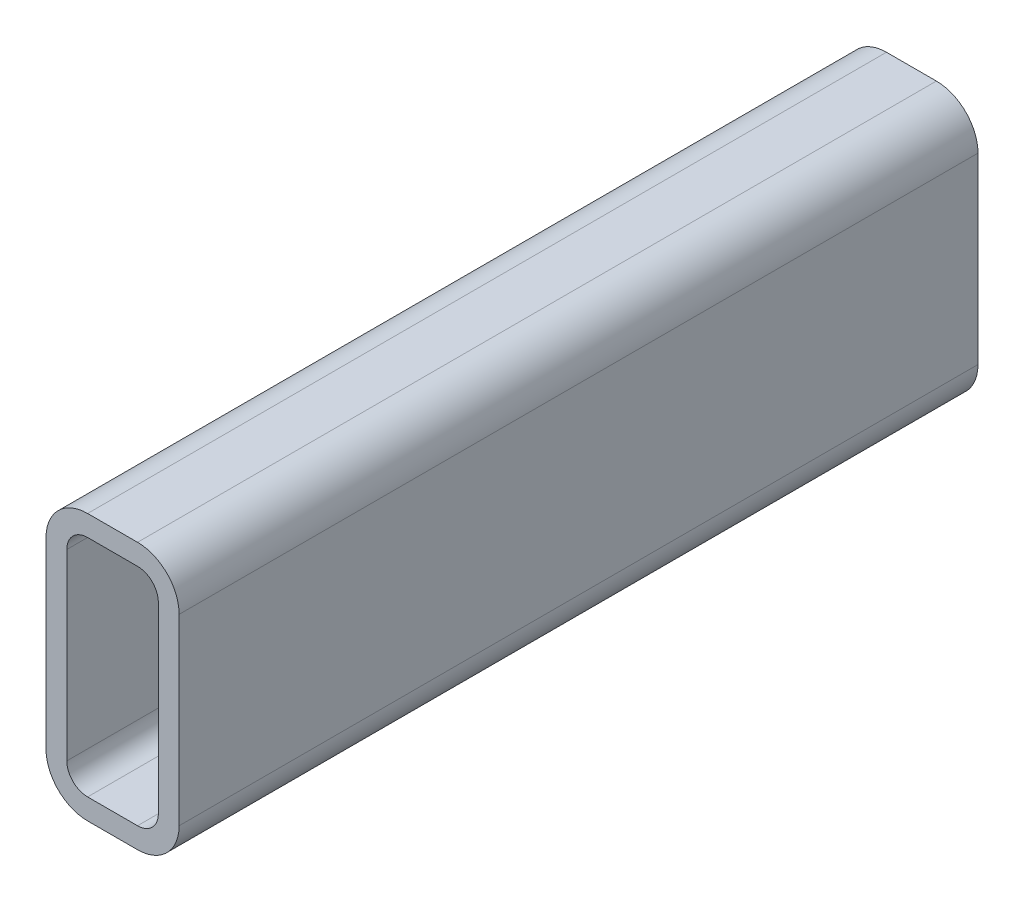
SolidWorks part; units mm, degrees
ref_plane "Front Plane" through (0, 0, 0) normal (0, 0, 1) x (1, 0, 0)
ref_plane "Top Plane" through (0, 0, 0) normal (0, 1, 0) x (1, 0, 0)
ref_plane "Right Plane" through (0, 0, 0) normal (1, 0, 0) x (0, 0, -1)
sketch "Sketch1" plane through (0, 0, 0) normal (0, 0, 1) x (1, 0, 0)
  line B0 (15.875, 101.6) -> (34.925, 101.6)
  arc B1 (50.8, 85.725) -> (34.925, 101.6) centre (34.925, 85.725) ccw
  line B2 (50.8, 85.725) -> (50.8, 15.875)
  arc B3 (34.925, 0) -> (50.8, 15.875) centre (34.925, 15.875) ccw
  line B4 (34.925, 0) -> (15.875, 0)
  arc B5 (0, 15.875) -> (15.875, 0) centre (15.875, 15.875) ccw
  line B6 (0, 15.875) -> (0, 85.725)
  arc B7 (15.875, 101.6) -> (0, 85.725) centre (15.875, 85.725) ccw
  line B8 (15.875, 93.6625) -> (34.925, 93.6625)
  arc B9 (42.8625, 85.725) -> (34.925, 93.6625) centre (34.925, 85.725) ccw
  line B10 (42.8625, 85.725) -> (42.8625, 15.875)
  arc B11 (34.925, 7.9375) -> (42.8625, 15.875) centre (34.925, 15.875) ccw
  line B12 (34.925, 7.9375) -> (15.875, 7.9375)
  arc B13 (7.9375, 15.875) -> (15.875, 7.9375) centre (15.875, 15.875) ccw
  line B14 (7.9375, 15.875) -> (7.9375, 85.725)
  arc B15 (15.875, 93.6625) -> (7.9375, 85.725) centre (15.875, 85.725) ccw
sketch_block_instance "HSS4x2x0.3125-1"
sketch_block "HSS4x2x0.3125"
extrude "Boss-Extrude1" add sketch "Sketch1" along normal blind 304.8
